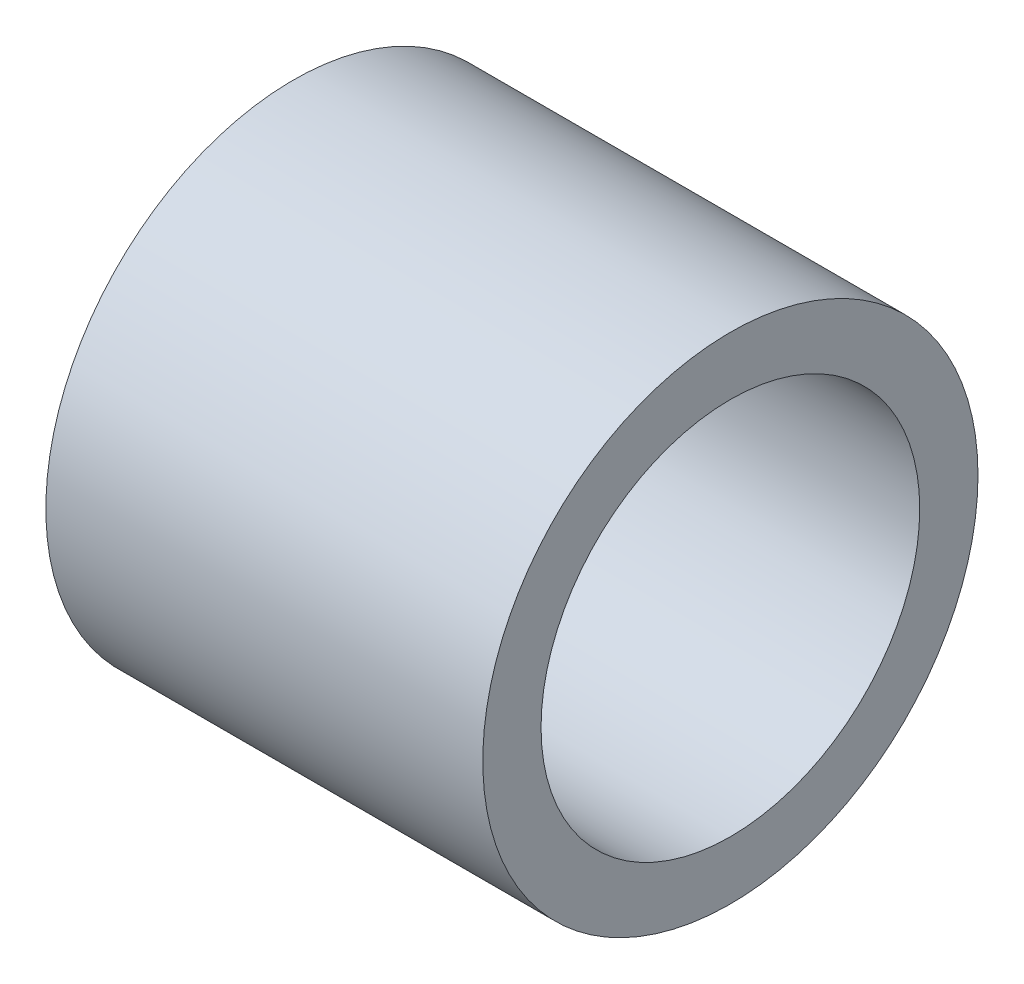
SolidWorks part; units mm, degrees
ref_plane "Front Plane" through (0, 0, 0) normal (0, 0, 1) x (1, 0, 0)
ref_plane "Top Plane" through (0, 0, 0) normal (0, 1, 0) x (1, 0, 0)
ref_plane "Right Plane" through (0, 0, 0) normal (1, 0, 0) x (0, 0, -1)
sketch "Sketch1" plane through (0, 0, 0) normal (1, 0, 0) x (0, 0, -1)
  circle A0 centre (0, 0) radius 8.5
  dimension "D1" = 17
extrude "Boss-Extrude2" add sketch "Sketch1" along normal blind 15 contours A0
sketch "Sketch3" plane through (15, 0, 0) normal (1, 0, 0) x (0, 0, -1)
  circle A0 centre (0, 0) radius 6.5
  dimension "D1" = 13
extrude "Cut-Extrude2" cut sketch "Sketch3" against normal through all contours A0
